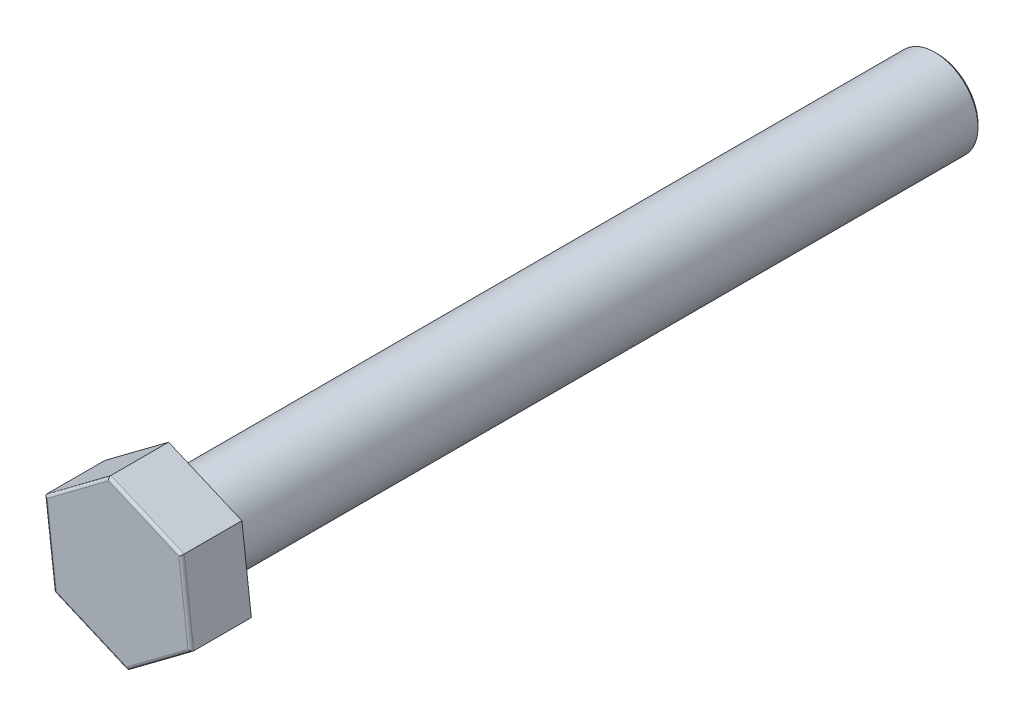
SolidWorks part; units mm, degrees
ref_plane "Front Plane" through (0, 0, 0) normal (0, 0, 1) x (1, 0, 0)
ref_plane "Top Plane" through (0, 0, 0) normal (0, 1, 0) x (1, 0, 0)
ref_plane "Right Plane" through (0, 0, 0) normal (1, 0, 0) x (0, 0, -1)
sketch "Sketch1" plane through (0, 0, 0) normal (0, 0, 1) x (1, 0, 0)
  circle A0 centre (0, 0) radius 3.9688
  dimension "D1" = 7.9375
extrude "Boss-Extrude1" add sketch "Sketch1" along normal blind 69.85
sketch "Sketch2" plane through (0, 0, 69.85) normal (0, 0, 1) x (1, 0, 0)
  line L1 (6.7402, -2.8868) -> (5.8701, 4.3938)
  line L2 (5.8701, 4.3938) -> (-0.8701, 7.2805)
  line L3 (-0.8701, 7.2805) -> (-6.7402, 2.8868)
  line L4 (-6.7402, 2.8868) -> (-5.8701, -4.3938)
  line L5 (-5.8701, -4.3938) -> (0.8701, -7.2805)
  line L6 (0.8701, -7.2805) -> (6.7402, -2.8868)
  circle A0 centre (0, 0) radius 6.35 construction
  dimension "D1" = 12.7
extrude "Boss-Extrude2" add sketch "Sketch2" along normal blind 5.5562
fillet "Fillet1" radius 0.254 6 edges at (-3.8051, 5.0837, 75.4062) (-6.3051, -0.7535, 75.4062) (-2.5, -5.8372, 75.4062) (3.8051, -5.0837, 75.4062) (6.3051, 0.7535, 75.4062) (2.5, 5.8372, 75.4062)
chamfer "Chamfer1" distance 0.254 angle 45 1 edges at (3.9688, 0, 0)
